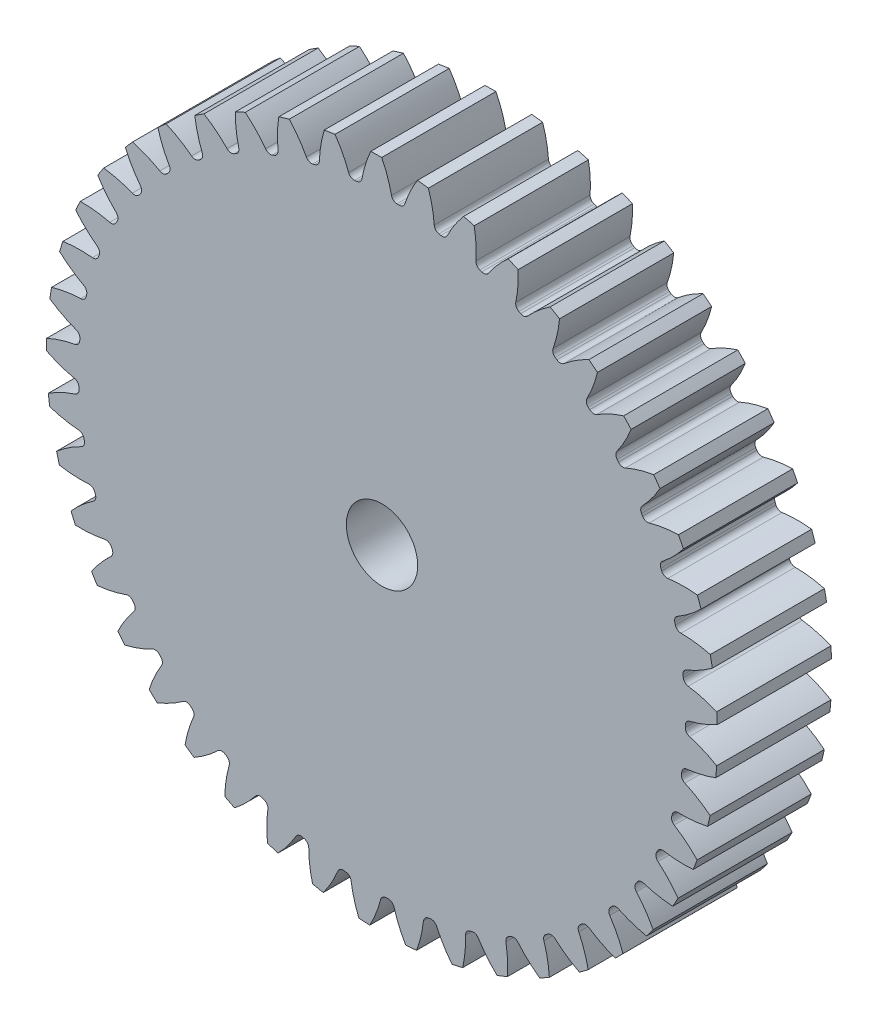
SolidWorks part; units mm, degrees
ref_plane "Front" through (0, 0, 0) normal (0, 0, 1) x (1, 0, 0)
ref_plane "Top" through (0, 0, 0) normal (0, 1, 0) x (1, 0, 0)
ref_plane "Right" through (0, 0, 0) normal (1, 0, 0) x (0, 0, -1)
sketch "Sketch3" plane through (0, 0, 0) normal (0, 0, 1) x (1, 0, 0)
  circle A0 centre (0, 0) radius 298.45
  dimension "od" = 596.9
extrude "gearBody" add sketch "Sketch3" along normal blind 101.6
sketch "Sketch2" plane through (0, 0, 0) normal (0, 0, 1) x (1, 0, 0)
  line L0 (0, 0) -> (248.0775, 102.7571) construction
  line L1 (297.8814, -21.3408) -> (0, 0) construction
  line L2 (0, 0) -> (36.3143, 0) construction
  line L3 (285.7083, 4.8799) -> (285.3567, -14.9872) construction
  line L5 (285.5325, -5.0536) -> (0, 0) construction
  line L7 (0, 0) -> (268.5172, 0) construction
  arc A0 (268.5172, -0.0935) -> (268.3523, -9.4086) centre (0, 0) ccw construction
  arc A1 (298.2588, 10.6818) -> (297.694, -21.2296) centre (0, 0) ccw construction
  arc A2 (285.7083, 4.8799) -> (285.3567, -14.9872) centre (0, 0) ccw construction
  arc A3 (269.8148, -5.7001) -> (269.8475, -3.8514) centre (0, 0) ccw
  arc A4 (297.8814, -21.3408) -> (273.5405, -10.773) centre (244.2859, -111.4714) ccw
  arc A5 (297.8814, -21.3408) -> (298.45, 10.7863) centre (0, 0) ccw
  arc A6 (298.45, 10.7863) -> (273.7504, 1.0865) centre (248.0775, 102.7571) cw
  arc A7 (269.8475, -3.8514) -> (273.7504, 1.0865) centre (275.0159, -3.9251) cw
  arc A8 (273.5405, -10.773) -> (269.8148, -5.7001) centre (274.9825, -5.8093) cw
  point P6 (298.45, 10.7863)
  point P22 (297.8814, -21.3408)
  dimension "baseDia" = 537.0343
  dimension "od" = 596.9
  dimension "pd" = 571.5
  dimension "rd" = 539.75
  dimension "rFillet" = 5.1689
  dimension "pointX" = 298.45
  dimension "pointY" = 10.7863
  dimension "CTT" = 19.8672
  dimension "flankCenterAngle" = 22.5
extrude "toothCut" cut sketch "Sketch2" along normal through all
pattern_circular "CirPattern1" count 45 over 360 about axis through (0, 0, 0) along (0, 0, 1) of "toothCut"
sketch "hub1Dia" plane through (0, 0, 0) normal (0, 0, -1) x (-1, 0, 0)
  circle A0 centre (0, 0) radius 12.7
  dimension "hub1Dia" = 25.4
sketch "hub2Dia" plane through (0, 0, 101.6) normal (0, 0, 1) x (1, 0, 0)
  circle A0 centre (0, 0) radius 12.7
  dimension "hub2dia" = 25.4
sketch "boreDia" plane through (0, 0, 0) normal (0, 0, 1) x (1, 0, 0)
  circle A0 centre (0, 0) radius 31.75
  dimension "boreDia" = 63.5
extrude "bore" cut sketch "boreDia" against normal mid plane 25400
